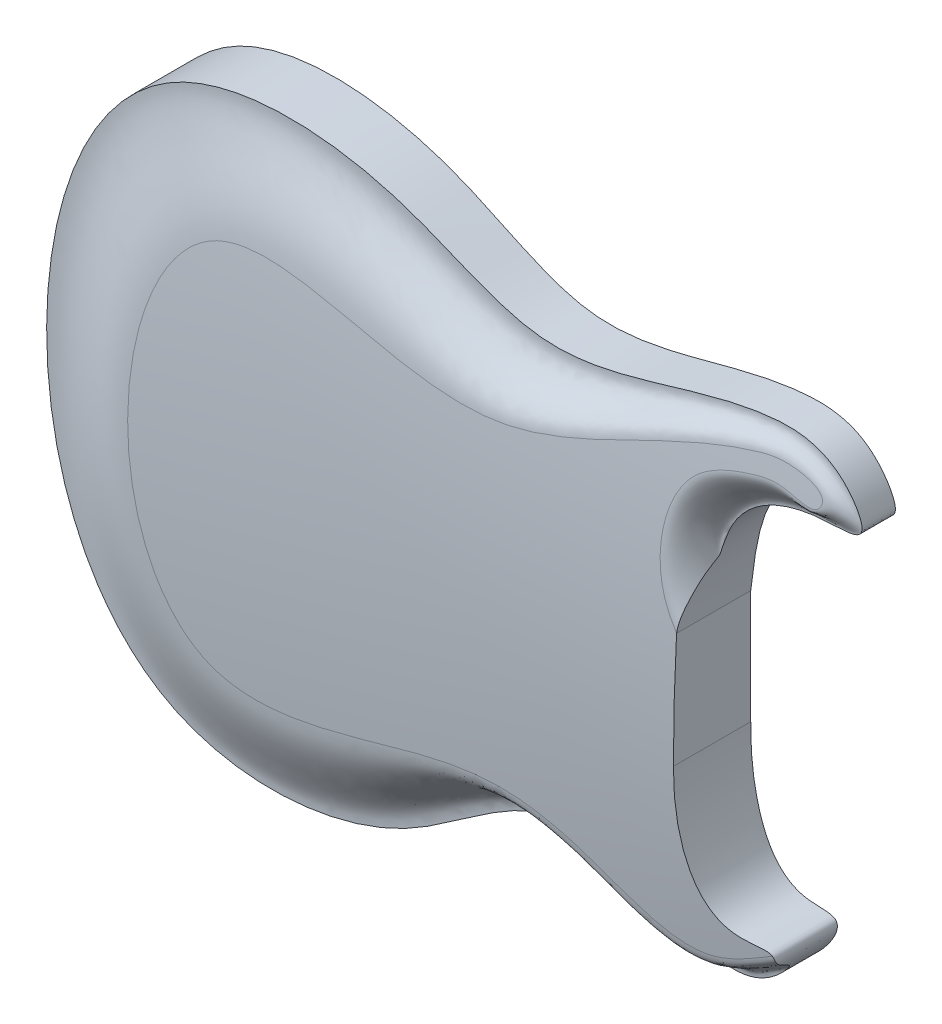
SolidWorks part; units mm, degrees
ref_plane "Front Plane" through (0, 0, 0) normal (0, 0, 1) x (1, 0, 0)
ref_plane "Top Plane" through (0, 0, 0) normal (0, 1, 0) x (1, 0, 0)
ref_plane "Right Plane" through (0, 0, 0) normal (1, 0, 0) x (0, 0, -1)
sketch "Sketch1" plane through (0, 0, 0) normal (0, 1, 0) x (1, 0, 0)
  line L0 (-380.9748, -51.9303) -> (97.4564, -30.6197) construction
  line L2 (-195.3061, 0) -> (195.3061, 0) construction
  line L3 (-592.5941, 1082.777) -> (269.486, 1121.1762) construction
  arc A0 (-380.9748, -51.9303) -> (97.4564, -30.6197) centre (-241.9267, 2207.5326) ccw
  point P2 (72.0815, -31.75)
  point P5 (-355.6, -50.8)
  dimension "D1" = 25.4
  dimension "D2" = 25.4
  dimension "D3" = 30.6197
  dimension "D4" = 97.4564
  dimension "D5" = 2.55
  dimension "D6" = 478.4312
  dimension "D7" = 12.7
  dimension "D8" = 1143
surface "Surface-Revolve1" sketch "Sketch1" parameters "D1"=30
ref_plane "Angled Plane" through (1.5542, 0, 34.8915) normal (0.0445, 0, 0.999) x (0.999, 0, -0.0445)
ref_plane "Plane1" through (0.989, 0, 22.204) normal (0.0445, 0, 0.999) x (0.999, 0, -0.0445)
sketch "Sketch2" plane through (-96.4883, 26.5703, 0) normal (0, 0, 1) x (1, 0, 0)
  line L1 (95.7101, 5.1797) -> (-196.7425, 5.1797) construction
  line L2 (-153.235, 105.762) -> (-153.235, -95.4025) construction
  line L3 (-65.0331, -89.9675) -> (-65.0331, 100.327) construction
  line L4 (-196.7425, 5.1797) -> (-260.2425, 5.1797) construction
  spline S0 degree 3 poles (207.7093, -26.5703) (148.9299, -5.4191) (71.935, 22.2868) (91.5633, 113.7917) (123.9586, 123.4584) (142.7496, 125.8642) (158.7707, 116.9684) (163.7795, 128.6124) (145.0344, 136.8672) (122.7071, 134.0197) (72.0163, 118.2186) (10.7256, 85.4574) (-70.8597, 100.4467) (-171.2577, 127.8192) (-210.7031, 4.9736) (-171.2932, -116.7149) (-66.5757, -90.9043) (-1.1762, -72.3825) (57.9574, -91.1798) (97.6769, -120.898) (155.3598, -95.4036) (183.8897, -70.5749) (207.7093, -49.8455) knots 0 0 0 0 0.128417 0.168213 0.191991 0.205462 0.220099 0.221295 0.235526 0.252941 0.284296 0.364515 0.419541 0.493426 0.585025 0.676623 0.750509 0.814713 0.847251 0.905045 0.920723 1 1 1 1
  dimension "D2" = 63.5
surface "Top Shape Trim"
sketch "Sketch3" plane through (0.989, 0, 22.204) normal (0.0445, 0, 0.999) x (0.999, 0, -0.0445)
  line L2 (29.1269, -97.8003) -> (104.2908, -52.1742) construction
  spline S1 degree 3 number of poles 252 (29.1269, -97.8003) -> (76.5867, 152.7438) construction
  spline S2 degree 3 number of poles 304 (110.6938, 8.1763) -> (104.2908, -52.1742)
  spline S3 degree 3 poles (76.5867, 152.7438) (77.0116, 152.023) (77.4158, 151.288) (78.1933, 149.7377) (78.5639, 148.9193) (79.2069, 147.255) (79.4824, 146.4068) (79.7761, 145.0925) (79.8529, 144.6501) (79.923, 143.9829) (79.9388, 143.7596) (79.9519, 143.3111) (79.9492, 143.0852) (79.9071, 142.4148) (79.8353, 141.9747) (79.5574, 141.1152) (79.3552, 140.7152) (78.8011, 139.9986) (78.4665, 139.6994) (77.7203, 139.1896) (77.3227, 138.9873) (76.4981, 138.6462) (76.0681, 138.5075) (75.2059, 138.2775) (74.7724, 138.1854) (73.467, 137.9542) (72.5904, 137.8587) (70.8312, 137.7244) (69.9485, 137.6867) (67.2957, 137.6172) (65.5204, 137.6282) (61.9713, 137.6325) (60.198, 137.626) (54.9028, 137.4324) (51.4013, 137.1025) (44.4679, 135.955) (41.0357, 135.1388) (36.8018, 133.7239) (35.9578, 133.4209) (34.2761, 132.7717) (33.4415, 132.4266) (30.978, 131.3356) (29.3812, 130.5312) (26.2852, 128.7568) (24.7861, 127.7868) (22.6175, 126.196) (21.908, 125.6431) (20.5172, 124.4895) (19.839, 123.8913) (17.8754, 122.0484) (16.6527, 120.7495) (14.3794, 118.0118) (13.3299, 116.572) (11.8745, 114.3155) (11.4091, 113.5472) (10.5158, 111.9803) (10.0891, 111.1837) (8.8743, 108.7783) (8.1462, 107.1459) (6.6995, 103.5299) (6.0067, 101.5373) (5.3859, 99.5193) knots 0.896592 0.896592 0.896592 0.896592 0.898438 0.898438 0.900391 0.900391 0.902344 0.902344 0.90332 0.90332 0.903809 0.903809 0.904297 0.904297 0.905273 0.905273 0.90625 0.90625 0.907227 0.907227 0.908203 0.908203 0.90918 0.90918 0.910156 0.910156 0.912109 0.912109 0.914063 0.914063 0.917969 0.917969 0.921875 0.921875 0.929688 0.929688 0.9375 0.9375 0.939453 0.939453 0.941406 0.941406 0.945313 0.945313 0.949219 0.949219 0.951172 0.951172 0.953125 0.953125 0.957031 0.957031 0.960938 0.960938 0.962891 0.962891 0.964844 0.964844 0.96875 0.96875 0.973375 0.973375 0.973375 0.973375 construction
  spline S4 degree 3 poles (5.3859, 99.5193) (3.3161, 93.0347) (11.5035, 51.9374) (81.5334, 21.0414) (110.6938, 8.1763) knots 0 0 0 0 0.583601 1 1 1 1 construction
sketch "Sketch4" plane through (0.989, 0, 22.204) normal (0.0445, 0, 0.999) x (0.999, 0, -0.0445)
  line L5 (110.6938, 8.1763) -> (104.2908, -52.1742)
  spline S0 degree 3 number of poles 304 (110.6938, 8.1763) -> (104.2908, -52.1742) construction
  spline S1 degree 3 number of poles 304 (110.6938, 8.1763) -> (104.2908, -52.1742)
surface "Construction Surface for Loft" sketch "Sketch4"
surface "Shape Loft"
delete or keep bodies "Body-Delete1" type delete bodies bodies 139
surface "Surface-Extend1" parameters "D1"=1.778
surface "Top Surface Knit"
sketch "Guitar Body Outline" plane through (0, 0, 0) normal (0, 0, 1) x (1, 0, 0)
  line L0 (0, 63.5) -> (0, 0)
  line L1 (0, 31.75) -> (-355.6, 31.75) construction
  line L2 (-286.0579, 184.15) -> (-286.0579, -120.65) construction
  line L3 (-163.7965, -118.8493) -> (-163.7965, 182.3493) construction
  spline S0 degree 3 poles (0, 63.5) (2.4707, 84.1763) (7.034, 122.3646) (46.8232, 139.9004) (87.3467, 136.0004) (67.0488, 173.6245) (2.0345, 177.7665) (-80.1818, 134.4451) (-173.9531, 195.6953) (-316.8898, 206.98) (-377.6823, 30.9941) (-317.9087, -140.8648) (-165.327, -137.5991) (-100.749, -67.3623) (-28.9342, -80.403) (20.3895, -123.3517) (55.7195, -68.503) (16.231, -73.6373) (1.1604, -36.0474) (0, -10.747) (0, 0) knots 0 0 0 0 0.044035 0.081332 0.096422 0.112661 0.147802 0.24108 0.300473 0.394246 0.522717 0.651187 0.744961 0.816316 0.847087 0.908535 0.926631 0.938591 0.975274 1 1 1 1
  dimension "D1" = 228.6
  dimension "D2" = 355.6
  dimension "D3" = 304.8
  dimension "D4" = 63.5
  dimension "D5" = 69.5421
extrude "Boss-Extrude1" add sketch "Guitar Body Outline" along normal up to surface (41.481 mm away) contours S0 L0
